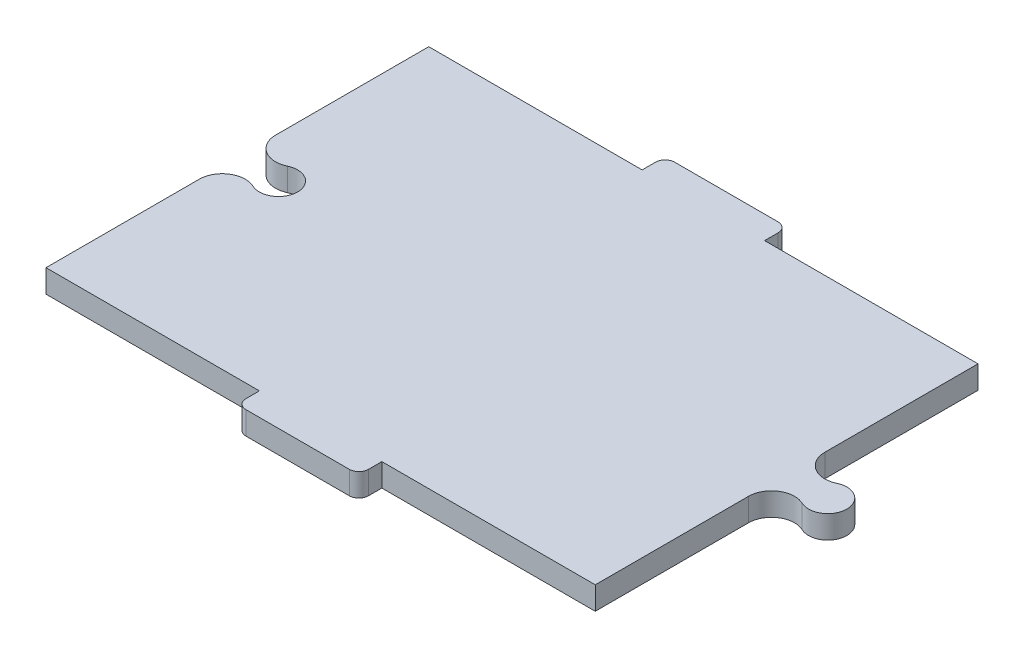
SolidWorks part; units mm, degrees
ref_plane "Front" through (0, 0, 0) normal (0, 0, 1) x (1, 0, 0)
ref_plane "Top" through (0, 0, 0) normal (0, 1, 0) x (1, 0, 0)
ref_plane "Right" through (0, 0, 0) normal (1, 0, 0) x (0, 0, -1)
sketch "Sketch1" plane through (0, 0, 0) normal (0, 1, 0) x (1, 0, 0)
  line L0 (-277.3243, 0) -> (233.4023, 0) construction
  line L1 (-143.505, -100) -> (-32, -100)
  line L2 (-143.505, -100) -> (-143.505, -19.935)
  line L3 (-143.505, 100) -> (-32, 100)
  line L4 (143.505, -100) -> (143.505, -19.9334)
  line L5 (-143.505, -100) -> (143.505, 100) construction
  line L6 (-143.505, 100) -> (143.505, -100) construction
  line L15 (32, 100) -> (143.505, 100)
  line L16 (32, -100) -> (143.505, -100)
  line L17 (-32, 100) -> (-32, 107)
  line L18 (-27, 112) -> (27, 112)
  line L19 (32, 107) -> (32, 100)
  line L20 (32, -107) -> (32, -100)
  line L21 (-27, -112) -> (27, -112)
  line L22 (-32, -100) -> (-32, -107)
  line L25 (-143.505, 19.935) -> (-143.505, 100)
  line L26 (143.505, 19.9334) -> (143.505, 100)
  arc A0 (27, 112) -> (32, 107) centre (27, 107) cw
  arc A1 (-32, 107) -> (-27, 112) centre (-27, 107) cw
  arc A2 (-32, -107) -> (-27, -112) centre (-27, -107) ccw
  arc A3 (27, -112) -> (32, -107) centre (27, -107) ccw
  arc A4 (143.505, 19.9334) -> (160.7079, 9.0399) centre (155.5555, 19.9334) ccw
  arc A5 (143.505, -19.9334) -> (160.7079, -9.0399) centre (155.5555, -19.9334) cw
  arc A6 (160.7079, 9.0399) -> (160.7079, -9.0399) centre (164.9835, 0) cw
  arc A10 (-143.505, 19.935) -> (-126.3053, 9.0408) centre (-131.455, 19.935) ccw
  arc A11 (-143.505, -19.935) -> (-126.3053, -9.0408) centre (-131.455, -19.935) cw
  arc A12 (-126.3053, 9.0408) -> (-126.3053, -9.0408) centre (-122.0317, 0) cw
  point P0 (0, 0)
  point P18 (32, 112)
  point P21 (-32, 112)
  point P40 (0, 0)
  dimension "D5" = 10
  dimension "D6" = 12.05
  dimension "D7" = 10
  dimension "D8" = 39.87
  dimension "D1" = 12
  dimension "D2" = 64
  dimension "D3" = 287.01
  dimension "D4" = 200
extrude "Boss-Extrude1" add sketch "Sketch1" along normal blind 12
